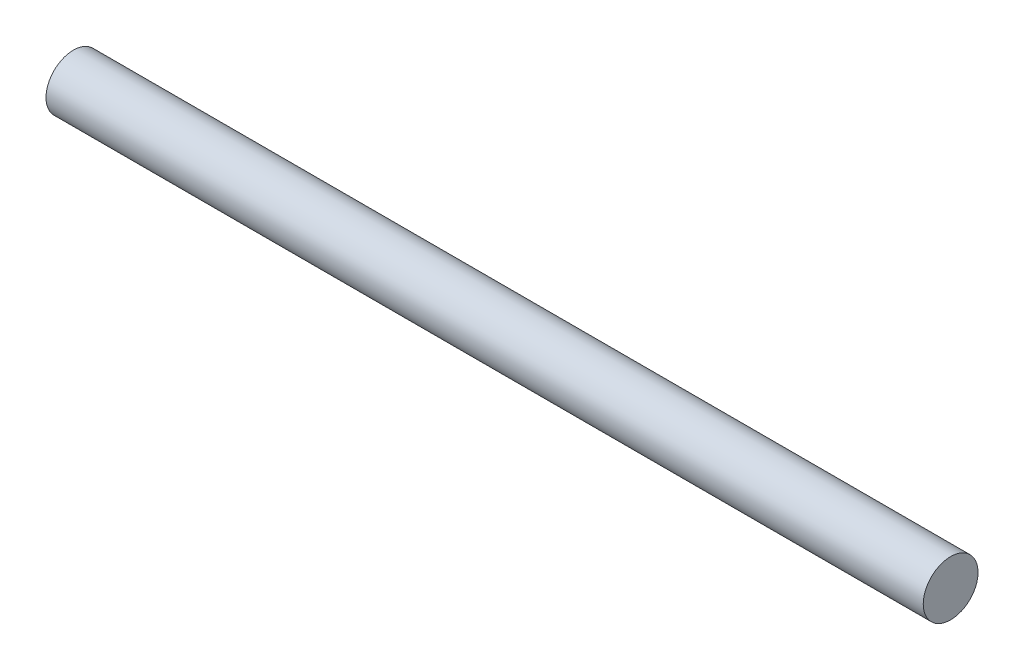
SolidWorks part; units mm, degrees
ref_plane "Front Plane" through (0, 0, 0) normal (0, 0, 1) x (1, 0, 0)
ref_plane "Top Plane" through (0, 0, 0) normal (0, 1, 0) x (1, 0, 0)
ref_plane "Right Plane" through (0, 0, 0) normal (1, 0, 0) x (0, 0, -1)
sketch "Sketch1" plane through (0, 0, 0) normal (0, 1, 0) x (1, 0, 0)
  line L1 (0, 0) -> (152.4, 0)
  line L2 (0, 0) -> (0, 4.7625)
  line L3 (0, 4.7625) -> (152.4, 4.7625)
  line L4 (152.4, 0) -> (152.4, 4.7625)
  dimension "D1" = 4.7625
  dimension "D2" = 152.4
revolve "Revolve1" add sketch "Sketch1" angle 360 about L1
